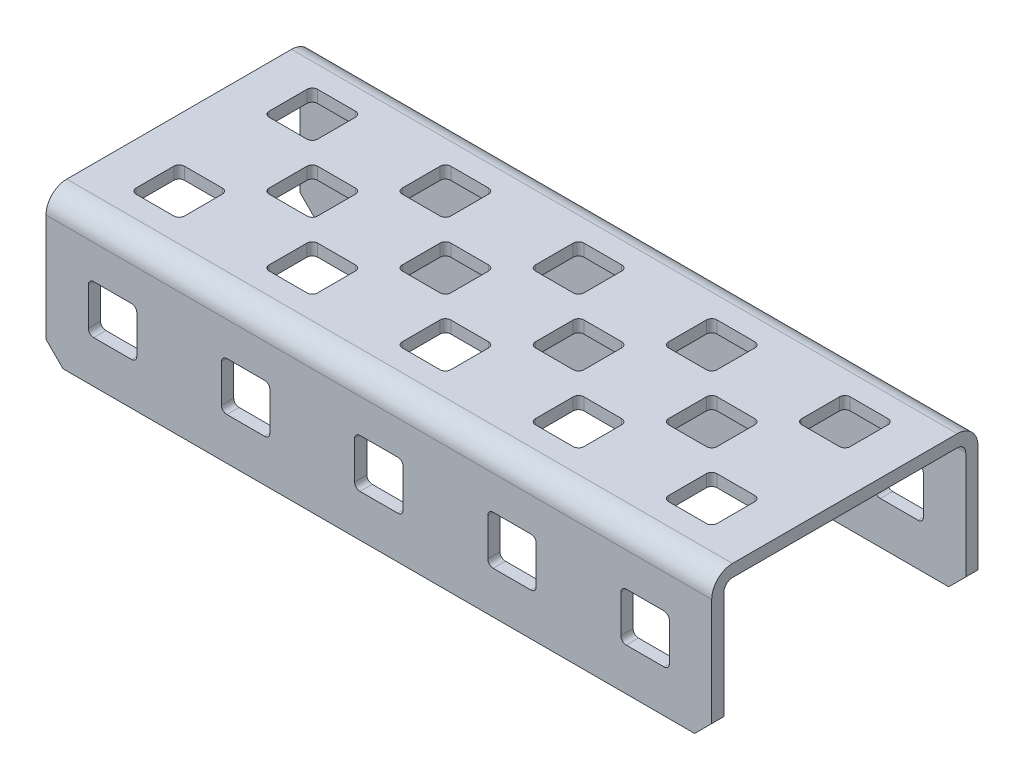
SolidWorks part; units mm, degrees
ref_plane "Front Plane" through (0, 0, 0) normal (0, 0, 1) x (1, 0, 0)
ref_plane "Top Plane" through (0, 0, 0) normal (0, 1, 0) x (1, 0, 0)
ref_plane "Right Plane" through (0, 0, 0) normal (1, 0, 0) x (0, 0, -1)
ref_plane "Plane1" through (0, -12.7, 0) normal (0, -1, 0) x (1, 0, 0)
sketch "Sketch1" plane through (0, -12.7, 0) normal (0, -1, 0) x (1, 0, 0)
  line L0 (-26.4652, -15.6006) -> (37.0348, -15.6006)
  line L1 (37.0348, -15.6006) -> (37.0348, 9.7994)
  line L2 (37.0348, 9.7994) -> (-26.4652, 9.7994)
  line L3 (-26.4652, 9.7994) -> (-26.4652, -15.6006)
extrude "Boss-Extrude1" add sketch "Sketch1" against normal blind 13.8684
sketch "Sketch2" plane through (37.0348, 0, 0) normal (1, 0, 0) x (0, 0, -1)
  line L0 (14.4322, -12.7) -> (14.4322, 0)
  line L1 (14.4322, 0) -> (-8.631, 0)
  line L2 (-8.631, 0) -> (-8.631, -12.7)
  line L3 (-8.631, -12.7) -> (14.4322, -12.7)
extrude "Cut-Extrude1" cut sketch "Sketch2" against normal through all
sketch "Sketch3" plane through (0, 0, 0) normal (0, -1, 0) x (1, 0, 0)
  line L0 (22.0234, -5.212) -> (26.6462, -5.212)
  line L1 (26.6462, -5.212) -> (26.6462, -0.5892)
  line L2 (26.6462, -0.5892) -> (22.0234, -0.5892)
  line L3 (22.0234, -0.5892) -> (22.0234, -5.212)
extrude "Cut-Extrude2" cut sketch "Sketch3" against normal through all
sketch "Sketch4" plane through (0, 0, 0) normal (0, -1, 0) x (1, 0, 0)
  line L0 (9.3234, -5.212) -> (13.9462, -5.212)
  line L1 (13.9462, -5.212) -> (13.9462, -0.5892)
  line L2 (13.9462, -0.5892) -> (9.3234, -0.5892)
  line L3 (9.3234, -0.5892) -> (9.3234, -5.212)
extrude "Cut-Extrude3" cut sketch "Sketch4" against normal through all
sketch "Sketch5" plane through (0, 0, 0) normal (0, -1, 0) x (1, 0, 0)
  line L0 (-17.8038, -6.9392) -> (-22.4266, -6.9392)
  line L1 (-22.4266, -6.9392) -> (-22.4266, -11.562)
  line L2 (-22.4266, -11.562) -> (-17.8038, -11.562)
  line L3 (-17.8038, -11.562) -> (-17.8038, -6.9392)
extrude "Cut-Extrude4" cut sketch "Sketch5" against normal through all
sketch "Sketch6" plane through (0, 0, 0) normal (0, -1, 0) x (1, 0, 0)
  line L0 (-17.8038, 5.7608) -> (-22.4266, 5.7608)
  line L1 (-22.4266, 5.7608) -> (-22.4266, 1.138)
  line L2 (-22.4266, 1.138) -> (-17.8038, 1.138)
  line L3 (-17.8038, 1.138) -> (-17.8038, 5.7608)
extrude "Cut-Extrude5" cut sketch "Sketch6" against normal through all
sketch "Sketch7" plane through (0, 0, 0) normal (0, -1, 0) x (1, 0, 0)
  line L0 (-11.4538, -0.5892) -> (-16.0766, -0.5892)
  line L1 (-16.0766, -0.5892) -> (-16.0766, -5.212)
  line L2 (-16.0766, -5.212) -> (-11.4538, -5.212)
  line L3 (-11.4538, -5.212) -> (-11.4538, -0.5892)
extrude "Cut-Extrude6" cut sketch "Sketch7" against normal through all
sketch "Sketch8" plane through (0, 0, 0) normal (0, -1, 0) x (1, 0, 0)
  line L0 (-5.1038, -6.9392) -> (-9.7266, -6.9392)
  line L1 (-9.7266, -6.9392) -> (-9.7266, -11.562)
  line L2 (-9.7266, -11.562) -> (-5.1038, -11.562)
  line L3 (-5.1038, -11.562) -> (-5.1038, -6.9392)
extrude "Cut-Extrude7" cut sketch "Sketch8" against normal through all
sketch "Sketch9" plane through (0, 0, 0) normal (0, -1, 0) x (1, 0, 0)
  line L0 (-5.1038, 5.7608) -> (-9.7266, 5.7608)
  line L1 (-9.7266, 5.7608) -> (-9.7266, 1.138)
  line L2 (-9.7266, 1.138) -> (-5.1038, 1.138)
  line L3 (-5.1038, 1.138) -> (-5.1038, 5.7608)
extrude "Cut-Extrude8" cut sketch "Sketch9" against normal through all
sketch "Sketch10" plane through (0, 0, 0) normal (0, -1, 0) x (1, 0, 0)
  line L0 (7.5962, -6.9392) -> (2.9734, -6.9392)
  line L1 (2.9734, -6.9392) -> (2.9734, -11.562)
  line L2 (2.9734, -11.562) -> (7.5962, -11.562)
  line L3 (7.5962, -11.562) -> (7.5962, -6.9392)
extrude "Cut-Extrude9" cut sketch "Sketch10" against normal through all
sketch "Sketch11" plane through (0, 0, 0) normal (0, -1, 0) x (1, 0, 0)
  line L0 (7.5962, 5.7608) -> (2.9734, 5.7608)
  line L1 (2.9734, 5.7608) -> (2.9734, 1.138)
  line L2 (2.9734, 1.138) -> (7.5962, 1.138)
  line L3 (7.5962, 1.138) -> (7.5962, 5.7608)
extrude "Cut-Extrude10" cut sketch "Sketch11" against normal through all
sketch "Sketch12" plane through (0, 0, 0) normal (0, -1, 0) x (1, 0, 0)
  line L0 (20.2962, -6.9392) -> (15.6734, -6.9392)
  line L1 (15.6734, -6.9392) -> (15.6734, -11.562)
  line L2 (15.6734, -11.562) -> (20.2962, -11.562)
  line L3 (20.2962, -11.562) -> (20.2962, -6.9392)
extrude "Cut-Extrude11" cut sketch "Sketch12" against normal through all
sketch "Sketch13" plane through (0, 0, 0) normal (0, -1, 0) x (1, 0, 0)
  line L0 (20.2962, 5.7608) -> (15.6734, 5.7608)
  line L1 (15.6734, 5.7608) -> (15.6734, 1.138)
  line L2 (15.6734, 1.138) -> (20.2962, 1.138)
  line L3 (20.2962, 1.138) -> (20.2962, 5.7608)
extrude "Cut-Extrude12" cut sketch "Sketch13" against normal through all
sketch "Sketch14" plane through (0, 0, 0) normal (0, -1, 0) x (1, 0, 0)
  line L0 (32.9962, -6.9392) -> (28.3734, -6.9392)
  line L1 (28.3734, -6.9392) -> (28.3734, -11.562)
  line L2 (28.3734, -11.562) -> (32.9962, -11.562)
  line L3 (32.9962, -11.562) -> (32.9962, -6.9392)
extrude "Cut-Extrude13" cut sketch "Sketch14" against normal through all
sketch "Sketch15" plane through (0, 0, 0) normal (0, -1, 0) x (1, 0, 0)
  line L0 (32.9962, 5.7608) -> (28.3734, 5.7608)
  line L1 (28.3734, 5.7608) -> (28.3734, 1.138)
  line L2 (28.3734, 1.138) -> (32.9962, 1.138)
  line L3 (32.9962, 1.138) -> (32.9962, 5.7608)
extrude "Cut-Extrude14" cut sketch "Sketch15" against normal through all
sketch "Sketch16" plane through (0, 0, 9.7994) normal (0, 0, 1) x (1, 0, 0)
  line L0 (-17.8038, -8.6614) -> (-17.8038, -4.0386)
  line L1 (-17.8038, -4.0386) -> (-22.4266, -4.0386)
  line L2 (-22.4266, -4.0386) -> (-22.4266, -8.6614)
  line L3 (-22.4266, -8.6614) -> (-17.8038, -8.6614)
extrude "Cut-Extrude15" cut sketch "Sketch16" against normal up to next
sketch "Sketch17" plane through (0, 0, 9.7994) normal (0, 0, 1) x (1, 0, 0)
  line L0 (-5.1038, -8.6614) -> (-5.1038, -4.0386)
  line L1 (-5.1038, -4.0386) -> (-9.7266, -4.0386)
  line L2 (-9.7266, -4.0386) -> (-9.7266, -8.6614)
  line L3 (-9.7266, -8.6614) -> (-5.1038, -8.6614)
extrude "Cut-Extrude16" cut sketch "Sketch17" against normal up to next
sketch "Sketch18" plane through (0, 0, 9.7994) normal (0, 0, 1) x (1, 0, 0)
  line L0 (7.5962, -8.6614) -> (7.5962, -4.0386)
  line L1 (7.5962, -4.0386) -> (2.9734, -4.0386)
  line L2 (2.9734, -4.0386) -> (2.9734, -8.6614)
  line L3 (2.9734, -8.6614) -> (7.5962, -8.6614)
extrude "Cut-Extrude17" cut sketch "Sketch18" against normal up to next
sketch "Sketch19" plane through (0, 0, 9.7994) normal (0, 0, 1) x (1, 0, 0)
  line L0 (20.2962, -8.6614) -> (20.2962, -4.0386)
  line L1 (20.2962, -4.0386) -> (15.6734, -4.0386)
  line L2 (15.6734, -4.0386) -> (15.6734, -8.6614)
  line L3 (15.6734, -8.6614) -> (20.2962, -8.6614)
extrude "Cut-Extrude18" cut sketch "Sketch19" against normal up to next
sketch "Sketch20" plane through (0, 0, 9.7994) normal (0, 0, 1) x (1, 0, 0)
  line L0 (32.9962, -8.6614) -> (32.9962, -4.0386)
  line L1 (32.9962, -4.0386) -> (28.3734, -4.0386)
  line L2 (28.3734, -4.0386) -> (28.3734, -8.6614)
  line L3 (28.3734, -8.6614) -> (32.9962, -8.6614)
extrude "Cut-Extrude19" cut sketch "Sketch20" against normal up to next
sketch "Sketch21" plane through (0, 0, -15.6006) normal (0, 0, -1) x (-1, 0, 0)
  line L0 (17.8038, -8.6614) -> (22.4266, -8.6614)
  line L1 (22.4266, -8.6614) -> (22.4266, -4.0386)
  line L2 (22.4266, -4.0386) -> (17.8038, -4.0386)
  line L3 (17.8038, -4.0386) -> (17.8038, -8.6614)
extrude "Cut-Extrude20" cut sketch "Sketch21" against normal through all
sketch "Sketch22" plane through (0, 0, -15.6006) normal (0, 0, -1) x (-1, 0, 0)
  line L0 (5.1038, -8.6614) -> (9.7266, -8.6614)
  line L1 (9.7266, -8.6614) -> (9.7266, -4.0386)
  line L2 (9.7266, -4.0386) -> (5.1038, -4.0386)
  line L3 (5.1038, -4.0386) -> (5.1038, -8.6614)
extrude "Cut-Extrude21" cut sketch "Sketch22" against normal through all
sketch "Sketch23" plane through (0, 0, -15.6006) normal (0, 0, -1) x (-1, 0, 0)
  line L0 (-7.5962, -8.6614) -> (-2.9734, -8.6614)
  line L1 (-2.9734, -8.6614) -> (-2.9734, -4.0386)
  line L2 (-2.9734, -4.0386) -> (-7.5962, -4.0386)
  line L3 (-7.5962, -4.0386) -> (-7.5962, -8.6614)
extrude "Cut-Extrude22" cut sketch "Sketch23" against normal through all
sketch "Sketch24" plane through (0, 0, -15.6006) normal (0, 0, -1) x (-1, 0, 0)
  line L0 (-20.2962, -8.6614) -> (-15.6734, -8.6614)
  line L1 (-15.6734, -8.6614) -> (-15.6734, -4.0386)
  line L2 (-15.6734, -4.0386) -> (-20.2962, -4.0386)
  line L3 (-20.2962, -4.0386) -> (-20.2962, -8.6614)
extrude "Cut-Extrude23" cut sketch "Sketch24" against normal through all
sketch "Sketch25" plane through (0, 0, -15.6006) normal (0, 0, -1) x (-1, 0, 0)
  line L0 (-32.9962, -8.6614) -> (-28.3734, -8.6614)
  line L1 (-28.3734, -8.6614) -> (-28.3734, -4.0386)
  line L2 (-28.3734, -4.0386) -> (-32.9962, -4.0386)
  line L3 (-32.9962, -4.0386) -> (-32.9962, -8.6614)
extrude "Cut-Extrude24" cut sketch "Sketch25" against normal through all
sketch "Sketch26" plane through (0, 1.1684, 0) normal (0, 1, 0) x (-1, 0, 0)
  line L0 (-1.2462, -0.5892) -> (-1.2462, -5.212)
  line L1 (-1.2462, -5.212) -> (3.3766, -5.212)
  line L2 (3.3766, -5.212) -> (3.3766, -0.5892)
  line L3 (3.3766, -0.5892) -> (-1.2462, -0.5892)
extrude "Cut-Extrude25" cut sketch "Sketch26" against normal through all
chamfer "Chamfer1" distance 1.6256 angle 45 4 edges at (-26.4652, -12.7, 9.2152) (-26.4652, -12.7, -15.0164) (37.0348, -12.7, -15.0164) (37.0348, -12.7, 9.2152)
fillet "Fillet1" radius 0.508 96 edges at (7.5962, 0.5842, -11.562) (32.9962, 0.5842, -11.562) (-17.8038, 0.5842, 1.138) (20.2962, -8.6614, 9.2152) (20.2962, 0.5842, -11.562) (20.2962, -4.0386, 9.2152) (-5.1038, 0.5842, -11.562) (15.6734, -4.0386, 9.2152) (9.3234, 0.5842, -0.5892) (15.6734, -8.6614, 9.2152) (20.2962, 0.5842, 1.138) (7.5962, -8.6614, 9.2152) (7.5962, 0.5842, 1.138) (7.5962, -4.0386, 9.2152) (-5.1038, 0.5842, 1.138) (2.9734, -4.0386, 9.2152) (-11.4538, 0.5842, -5.212) (2.9734, -8.6614, 9.2152) (32.9962, -4.0386, 9.2152) (-5.1038, -8.6614, 9.2152) (22.0234, 0.5842, -0.5892) (-5.1038, -4.0386, 9.2152) (28.3734, 0.5842, -6.9392) (-9.7266, -4.0386, 9.2152) (15.6734, 0.5842, 5.7608) (-9.7266, -8.6614, 9.2152) (15.6734, 0.5842, -6.9392) (-17.8038, -8.6614, 9.2152) (2.9734, 0.5842, 5.7608) (-17.8038, -4.0386, 9.2152) (2.9734, 0.5842, -6.9392) (-22.4266, -4.0386, 9.2152) (-9.7266, 0.5842, 5.7608) (-22.4266, -8.6614, 9.2152) (-9.7266, 0.5842, -6.9392) (32.9962, -8.6614, -15.0164) (-16.0766, 0.5842, -0.5892) (28.3734, -8.6614, -15.0164) (-17.8038, 0.5842, -11.562) (28.3734, -4.0386, -15.0164) (13.9462, 0.5842, -5.212) (32.9962, -4.0386, -15.0164) (26.6462, 0.5842, -5.212) (20.2962, -8.6614, -15.0164) (28.3734, 0.5842, -11.562) (15.6734, -8.6614, -15.0164) (32.9962, 0.5842, -6.9392) (15.6734, -4.0386, -15.0164) (15.6734, 0.5842, 1.138) (20.2962, -4.0386, -15.0164) (20.2962, 0.5842, 5.7608) (7.5962, -8.6614, -15.0164) (15.6734, 0.5842, -11.562) (2.9734, -8.6614, -15.0164) (20.2962, 0.5842, -6.9392) (2.9734, -4.0386, -15.0164) (2.9734, 0.5842, 1.138) (7.5962, -4.0386, -15.0164) (7.5962, 0.5842, 5.7608) (-5.1038, -8.6614, -15.0164) (2.9734, 0.5842, -11.562) (-9.7266, -8.6614, -15.0164) (7.5962, 0.5842, -6.9392) (-9.7266, -4.0386, -15.0164) (-9.7266, 0.5842, 1.138) (-5.1038, -4.0386, -15.0164) (-5.1038, 0.5842, 5.7608) (-17.8038, -8.6614, -15.0164) (-9.7266, 0.5842, -11.562) (-22.4266, -8.6614, -15.0164) (-5.1038, 0.5842, -6.9392) (-22.4266, -4.0386, -15.0164) (-16.0766, 0.5842, -5.212) (-17.8038, -4.0386, -15.0164) (-11.4538, 0.5842, -0.5892) (28.3734, -4.0386, 9.2152) (-22.4266, 0.5842, 1.138) (-17.8038, 0.5842, 5.7608) (28.3734, -8.6614, 9.2152) (-22.4266, 0.5842, 5.7608) (-22.4266, 0.5842, -11.562) (-3.3766, 0.5842, -5.212) (-17.8038, 0.5842, -6.9392) (-22.4266, 0.5842, -6.9392) (32.9962, -8.6614, 9.2152) (1.2462, 0.5842, -5.212) (9.3234, 0.5842, -5.212) (1.2462, 0.5842, -0.5892) (13.9462, 0.5842, -0.5892) (-3.3766, 0.5842, -0.5892) (22.0234, 0.5842, -5.212) (28.3734, 0.5842, 1.138) (26.6462, 0.5842, -0.5892) (32.9962, 0.5842, 5.7608) (28.3734, 0.5842, 5.7608) (32.9962, 0.5842, 1.138)
fillet "Fillet2" radius 0.8128 2 edges at (5.2848, 0, -14.4322) (5.2848, 0, 8.631)
fillet "Fillet3" radius 1.9812 2 edges at (5.2848, 1.1684, -15.6006) (5.2848, 1.1684, 9.7994)
